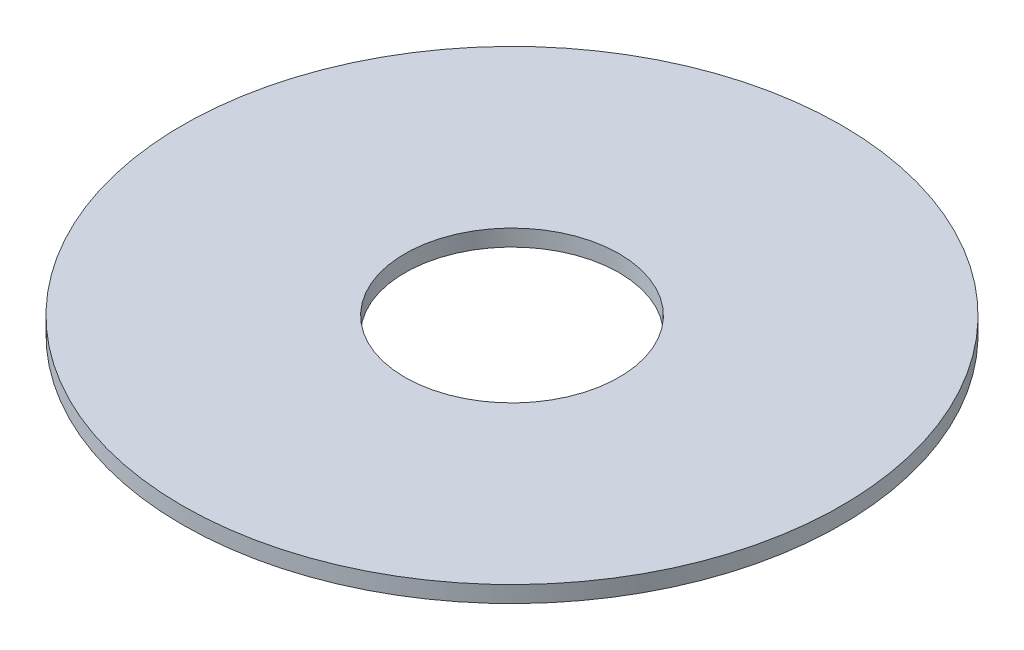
SolidWorks part; units mm, degrees
ref_plane "Front Plane" through (0, 0, 0) normal (0, 0, 1) x (1, 0, 0)
ref_plane "Top Plane" through (0, 0, 0) normal (0, 1, 0) x (1, 0, 0)
ref_plane "Right Plane" through (0, 0, 0) normal (1, 0, 0) x (0, 0, -1)
sketch "Sketch1" plane through (0, 0, 0) normal (0, 1, 0) x (1, 0, 0)
  circle A0 centre (0, 0) radius 5.08
extrude "Boss-Extrude1" add sketch "Sketch1" along normal blind 0.254
sketch "Sketch2" plane through (0, 0.254, 0) normal (0, 1, 0) x (1, 0, 0)
  circle A0 centre (0, 0) radius 1.651
extrude "Cut-Extrude1" cut sketch "Sketch2" against normal through all
